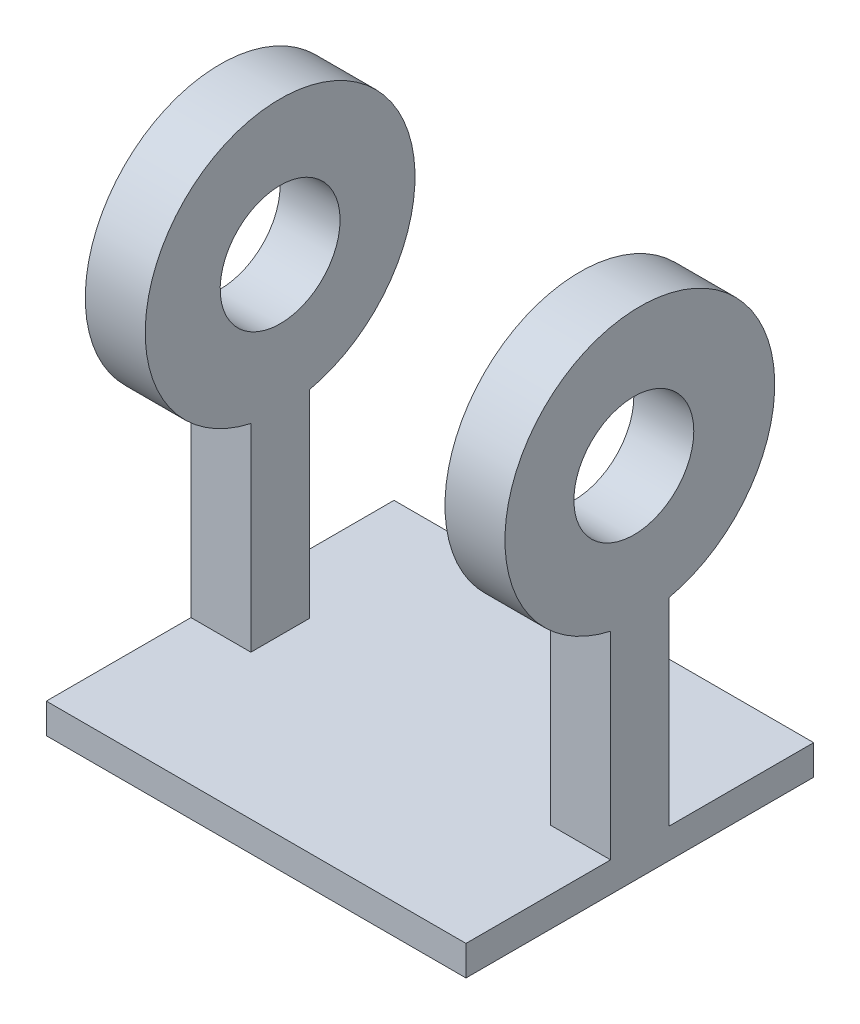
SolidWorks part; units mm, degrees
ref_plane "Plan de face" through (0, 0, 0) normal (0, 0, 1) x (1, 0, 0)
ref_plane "Plan de dessus" through (0, 0, 0) normal (0, 1, 0) x (1, 0, 0)
ref_plane "Plan de droite" through (0, 0, 0) normal (1, 0, 0) x (0, 0, -1)
sketch "Esquisse3" plane through (0, 0, 0) normal (1, 0, 0) x (0, 0, -1)
  line L0 (0, 0) -> (24.125, 0)
  line L1 (24.125, 0) -> (24.125, -5)
  line L2 (24.125, -5) -> (-33.875, -5)
  line L3 (-33.875, -5) -> (-33.875, 0)
  line L4 (-33.875, 0) -> (-9.75, 0)
  line L5 (-9.75, 0) -> (-9.75, 33.0345)
  line L6 (-9.75, 33.0345) -> (0, 33.0345)
  line L7 (0, 33.0345) -> (0, 0)
  circle A0 centre (-4.875, 55) radius 22.5
  circle A1 centre (-4.875, 55) radius 10
  dimension "D6" = 45
  dimension "D7" = 20
  dimension "D1" = 5
  dimension "D2" = 9.75
  dimension "D3" = 58
  dimension "D4" = 24.125
  dimension "D5" = 24.125
  dimension "D8" = 60
extrude "Boss.-Extru.1" add sketch "Esquisse3" along normal blind 70 contours L0 L1 L2 L3 L4 L5 L6 L7
sketch "Esquisse4" plane through (70, 0, 0) normal (1, 0, 0) x (0, 0, -1)
  circle A0 centre (-4.875, 55) radius 22.5
  circle A1 centre (-4.875, 55) radius 10
  dimension "D1" = 20
  dimension "D2" = 45
extrude "Boss.-Extru.2" add sketch "Esquisse4" against normal blind 70
sketch "Esquisse5" plane through (0, 0, 9.75) normal (0, 0, 1) x (1, 0, 0)
  line L0 (70, 0) -> (0, 0) construction
  line L1 (10, 0) -> (60, 0)
  line L2 (10, 0) -> (10, 77.5)
  line L3 (10, 77.5) -> (60, 77.5)
  line L4 (60, 0) -> (60, 77.5)
  line L5 (70, 77.5) -> (0, 77.5) construction
  line L6 (0, 77.5) -> (0, 33.0345) construction
  dimension "D1" = 50
  dimension "D2" = 10
extrude "Enlèv. mat.-Extru.3" cut sketch "Esquisse5" against normal blind 43
sketch "Esquisse8" plane through (0, 0, 9.75) normal (0, 0, -1) x (-1, 0, 0)
  line L1 (-60, 33.0345) -> (-10, 33.0345)
  line L2 (-60, 33.0345) -> (-60, 76.9655)
  line L3 (-60, 76.9655) -> (-10, 76.9655)
  line L4 (-10, 33.0345) -> (-10, 76.9655)
extrude "Enlèv. mat.-Extru.4" cut sketch "Esquisse8" against normal blind 43
sketch "Esquisse9" plane through (70, 0, 0) normal (1, 0, 0) x (0, 0, -1)
  circle A0 centre (-4.875, 55) radius 10
extrude "Boss.-Extru.3" add sketch "Esquisse9" against normal up to surface (10 mm away)
sketch "Esquisse10" plane through (70, 0, 0) normal (1, 0, 0) x (0, 0, -1)
  line L0 (-33.5838, 55) -> (27.3634, 55) construction
  line L1 (-4.875, 81.5523) -> (-4.875, 25.5217) construction
  line L2 (-5.875, 81.5523) -> (-5.875, 38.9728) construction
  circle A0 centre (-5.875, 55) radius 10
  dimension "D2" = 20
  dimension "D1" = 1
extrude "Enlèv. mat.-Extru.5" cut sketch "Esquisse10" against normal up to surface (10 mm away)
